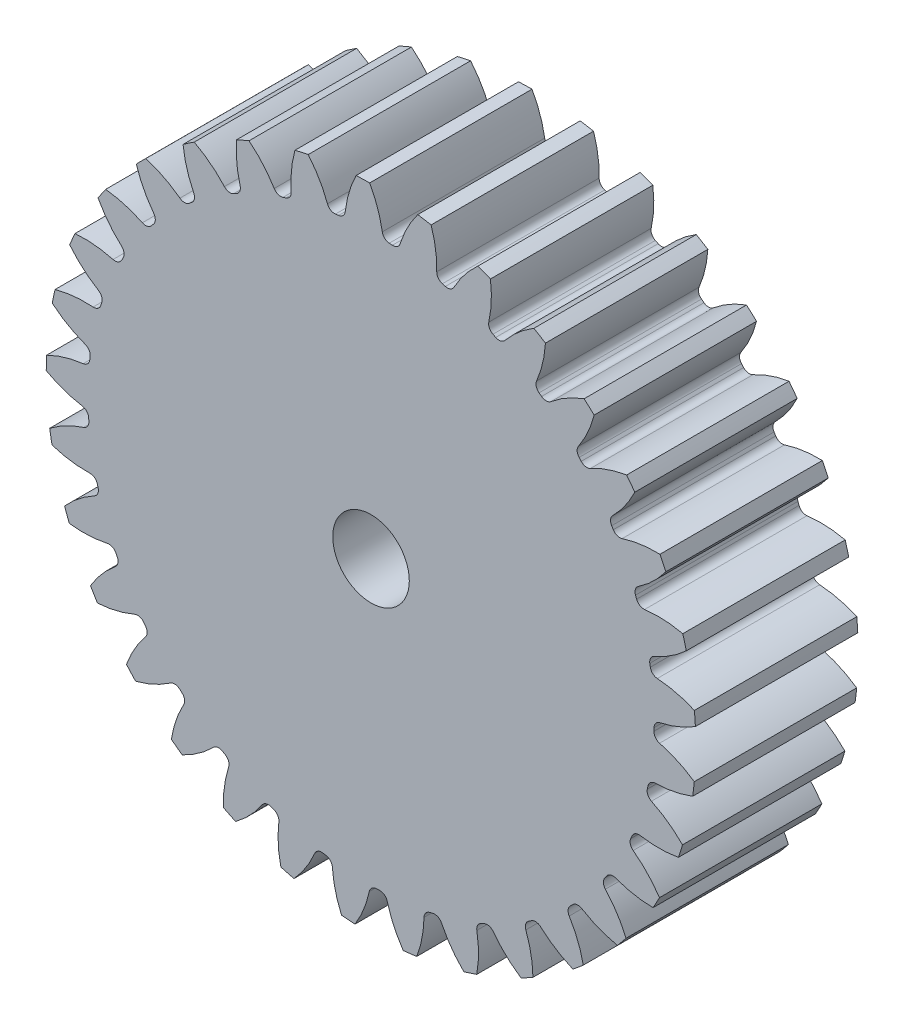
SolidWorks part; units mm, degrees
ref_plane "Front" through (0, 0, 0) normal (0, 0, 1) x (1, 0, 0)
ref_plane "Top" through (0, 0, 0) normal (0, 1, 0) x (1, 0, 0)
ref_plane "Right" through (0, 0, 0) normal (1, 0, 0) x (0, 0, -1)
sketch "Sketch3" plane through (0, 0, 0) normal (0, 0, 1) x (1, 0, 0)
  circle A0 centre (0, 0) radius 177.8
  dimension "od" = 355.6
extrude "gearBody" add sketch "Sketch3" along normal blind 88.9
sketch "Sketch2" plane through (0, 0, 0) normal (0, 0, 1) x (1, 0, 0)
  line L0 (0, 0) -> (145.5388, 60.2841) construction
  line L1 (177.1999, -17.3439) -> (0, 0) construction
  line L2 (0, 0) -> (36.3143, 0) construction
  line L3 (167.5877, 4.186) -> (167.2307, -11.7077) construction
  line L5 (167.4092, -3.7609) -> (0, 0) construction
  line L7 (0, 0) -> (157.5301, 0) construction
  arc A0 (157.5254, 1.2124) -> (157.312, -8.2852) centre (0, 0) ccw construction
  arc A1 (177.5609, 9.2181) -> (176.9678, -17.1826) centre (0, 0) ccw construction
  arc A2 (167.5877, 4.186) -> (167.2307, -11.7077) centre (0, 0) ccw construction
  arc A3 (154.8793, -4.3365) -> (154.9178, -2.6231) centre (0, 0) ccw
  arc A4 (177.1999, -17.3439) -> (157.9646, -8.4523) centre (142.6848, -66.7591) ccw
  arc A5 (177.1999, -17.3439) -> (177.8, 9.3688) centre (0, 0) ccw
  arc A6 (177.8, 9.3688) -> (158.1848, 1.35) centre (145.5388, 60.2841) cw
  arc A7 (154.9178, -2.6231) -> (158.1848, 1.35) centre (159.0523, -2.6931) cw
  arc A8 (157.9646, -8.4523) -> (154.8793, -4.3365) centre (159.0128, -4.4522) cw
  point P6 (177.8, 9.3688)
  point P22 (177.1999, -17.3439)
  dimension "baseDia" = 315.0601
  dimension "od" = 355.6
  dimension "pd" = 335.28
  dimension "rd" = 309.88
  dimension "rFillet" = 4.1351
  dimension "pointX" = 177.8
  dimension "pointY" = 9.3688
  dimension "CTT" = 15.8937
  dimension "flankCenterAngle" = 22.5
extrude "toothCut" cut sketch "Sketch2" along normal through all
pattern_circular "CirPattern1" count 33 over 360 about axis through (0, 0, 0) along (0, 0, 1) of "toothCut"
sketch "hub1Dia" plane through (0, 0, 0) normal (0, 0, -1) x (-1, 0, 0)
  circle A0 centre (0, 0) radius 12.7
  dimension "hub1Dia" = 25.4
sketch "hub2Dia" plane through (0, 0, 88.9) normal (0, 0, 1) x (1, 0, 0)
  circle A0 centre (0, 0) radius 12.7
  dimension "hub2dia" = 25.4
sketch "boreDia" plane through (0, 0, 0) normal (0, 0, 1) x (1, 0, 0)
  circle A0 centre (0, 0) radius 20.955
  dimension "boreDia" = 41.91
extrude "bore" cut sketch "boreDia" against normal mid plane 25400
